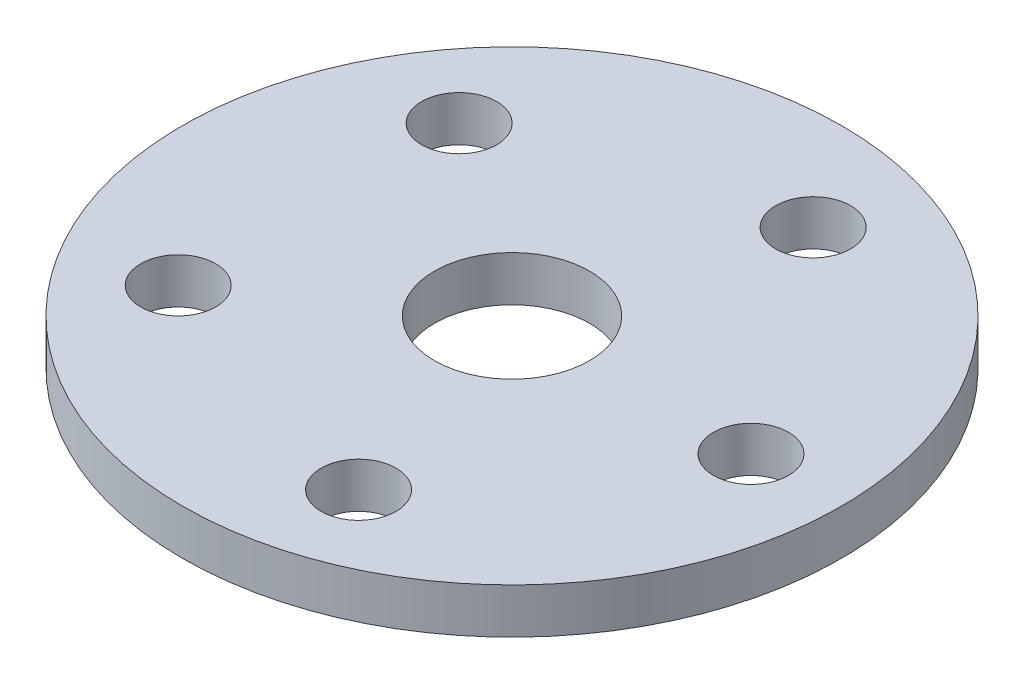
SolidWorks part; units mm, degrees
ref_plane "Front Plane" through (0, 0, 0) normal (0, 0, 1) x (1, 0, 0)
ref_plane "Top Plane" through (0, 0, 0) normal (0, 1, 0) x (1, 0, 0)
ref_plane "Right Plane" through (0, 0, 0) normal (1, 0, 0) x (0, 0, -1)
sketch "Sketch1" plane through (0, 0, 0) normal (0, 1, 0) x (1, 0, 0)
  circle A0 centre (0, 0) radius 64.7559
extrude "Extrude1" add sketch "Sketch1" along normal blind 8.89
sketch "Sketch2" plane through (0, 8.89, 0) normal (0, 1, 0) x (-1, 0, 0)
  circle A0 centre (-46.9572, 0) radius 7.3669
extrude "Cut-Extrude1" cut sketch "Sketch2" against normal blind 8.89
sketch "Sketch3" plane through (0, 8.89, 0) normal (0, 1, 0) x (-1, 0, 0)
  circle A0 centre (0, 0) radius 15.2461
extrude "Cut-Extrude2" cut sketch "Sketch3" against normal blind 8.89
pattern_circular "CirPattern1" count 5 over 360 about axis through (0, 0, 0) along (0, 1, 0) of "Cut-Extrude1"
